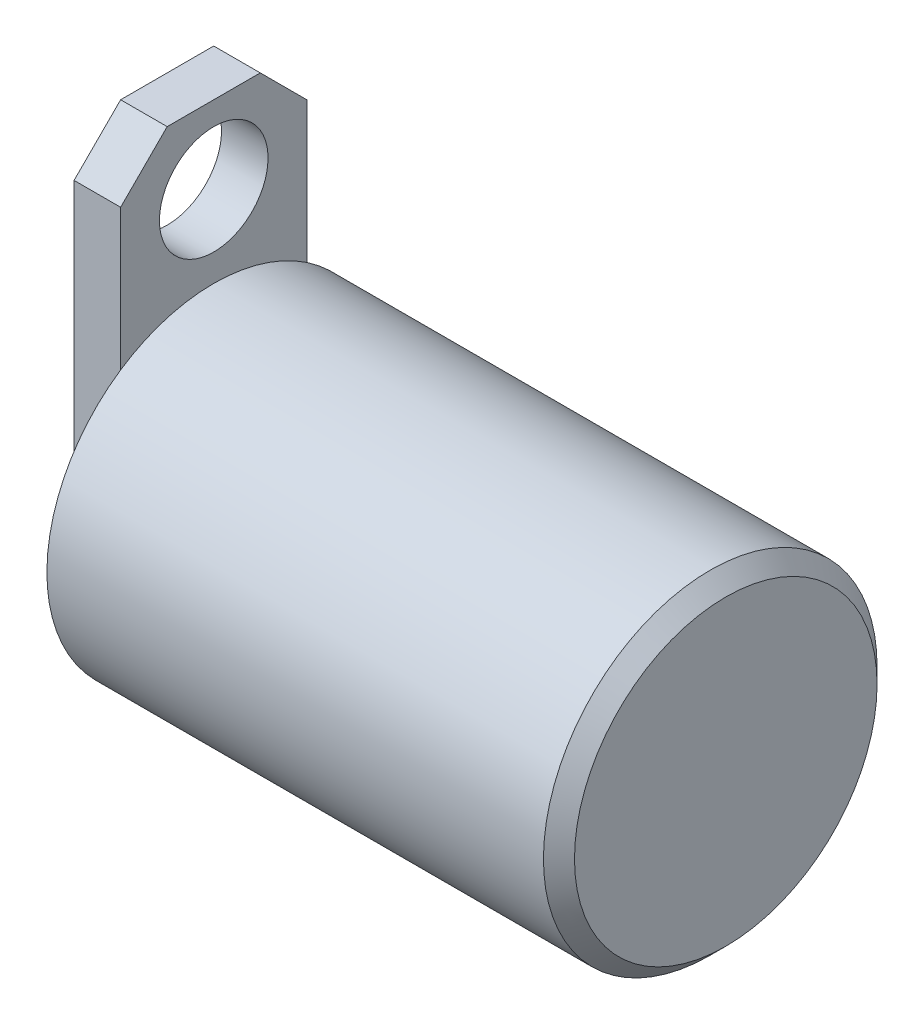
SolidWorks part; units mm, degrees
ref_plane "Front Plane" through (0, 0, 0) normal (0, 0, 1) x (1, 0, 0)
ref_plane "Top Plane" through (0, 0, 0) normal (0, 1, 0) x (1, 0, 0)
ref_plane "Right Plane" through (0, 0, 0) normal (1, 0, 0) x (0, 0, -1)
sketch "Sketch1" plane through (0, 0, 0) normal (1, 0, 0) x (0, 0, -1)
  circle A0 centre (0, 0) radius 10.75
  dimension "D1" = 21.5
extrude "Boss-Extrude1" add sketch "Sketch1" along normal blind 33
sketch "Sketch2" plane through (0, 0, 0) normal (-1, 0, 0) x (0, 0, 1)
  line L0 (0, 0) -> (6, 0)
  line L1 (6, 0) -> (6, 21)
  line L2 (6, 21) -> (-6, 21)
  line L3 (-6, 21) -> (-6, 0)
  line L4 (-6, 0) -> (0, 0)
  line L5 (0, 0) -> (0, 16) construction
  circle A0 centre (0, 16) radius 3.5
  dimension "D2" = 7
  dimension "D1" = 16
  dimension "D3" = 12
  dimension "D4" = 21
extrude "Boss-Extrude2" add sketch "Sketch2" along normal blind 3
chamfer "Chamfer1" distance 3 angle 45 2 edges at (-1.5, 21, -6) (-1.5, 21, 6)
chamfer "Chamfer2" distance 1 angle 45 1 edges at (33, 0, -10.75)
